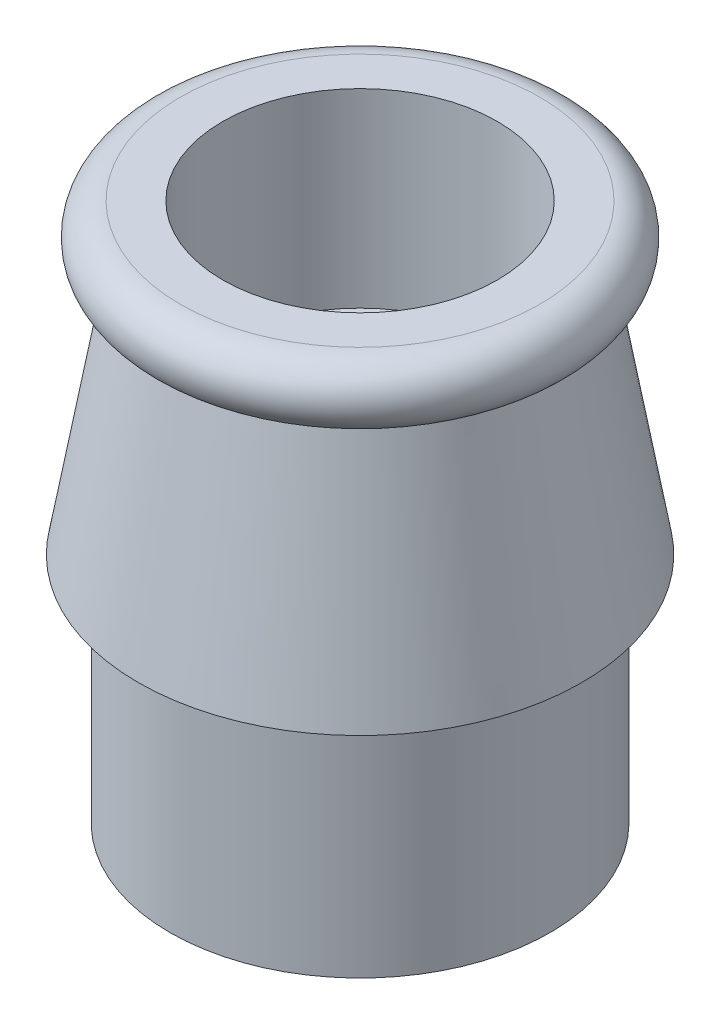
SolidWorks part; units mm, degrees
ref_plane "Anteriore" through (0, 0, 0) normal (0, 0, 1) x (1, 0, 0)
ref_plane "Superiore" through (0, 0, 0) normal (0, 1, 0) x (1, 0, 0)
ref_plane "Destro" through (0, 0, 0) normal (1, 0, 0) x (0, 0, -1)
sketch "Schizzo1" plane through (0, 0, 0) normal (0, 0, 1) x (1, 0, 0)
  line L0 (0, 90) -> (0, -90) construction
  line L1 (6.5, 8.25) -> (6.5, 17.25)
  line L2 (6.5, 17.25) -> (8.5, 17.25)
  line L3 (8.5, 14.25) -> (10.5, 2.75)
  line L4 (10.5, 2.75) -> (9, 2.75)
  line L5 (9, 2.75) -> (9, -8.25)
  line L6 (9, -8.25) -> (0, -8.25)
  line L7 (0, -8.25) -> (0, 8.25)
  line L8 (0, 8.25) -> (6.5, 8.25)
  arc A0 (8.5, 17.25) -> (8.5, 14.25) centre (8.5, 15.75) cw
  dimension "D1" = 1.5
  dimension "D2" = 8.5
  dimension "D3" = 6.5
  dimension "D4" = 10.5
  dimension "D5" = 9
  dimension "D6" = 25.5
  dimension "D7" = 11
  dimension "D8" = 9
revolve "Rivoluzione1" add sketch "Schizzo1" angle 360 about L0
sketch "Schizzo2" plane through (0, -8.25, 0) normal (0, -1, 0) x (1, 0, 0)
  line L1 (-4.3301, 2.5) -> (-4.3301, -2.5)
  line L2 (-4.3301, -2.5) -> (0, -5)
  line L3 (0, -5) -> (4.3301, -2.5)
  line L4 (4.3301, -2.5) -> (4.3301, 2.5)
  line L5 (4.3301, 2.5) -> (0, 5)
  line L6 (0, 5) -> (-4.3301, 2.5)
  circle A0 centre (0, 0) radius 5 construction
  dimension "D1" = 10
extrude "Taglio-Estrusione1" cut sketch "Schizzo2" against normal up to next
